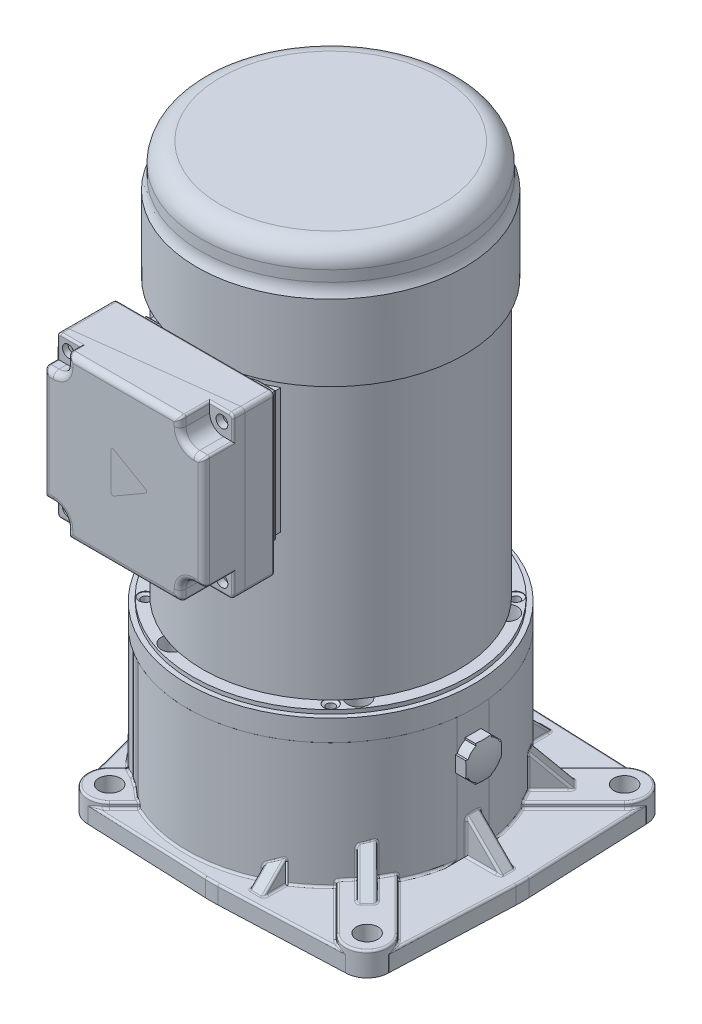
SolidWorks part; units mm, degrees
ref_plane "前视基准面" through (0, 0, 0) normal (0, 0, 1) x (1, 0, 0)
ref_plane "上视基准面" through (0, 0, 0) normal (0, 1, 0) x (1, 0, 0)
ref_plane "右视基准面" through (0, 0, 0) normal (1, 0, 0) x (0, 0, -1)
imported_body "接线盒座-1-surface1"
imported_body "接线盒座-1-surface2"
imported_body "接线盒座-1-surface3"
imported_body "接线盒座-1-surface4"
imported_body "接线盒座-1-surface5"
imported_body "接线盒盖-1-surface1"
imported_body "接线盒盖-1-surface2"
imported_body "接线盒盖-1-surface3"
imported_body "立式箱体装配.SLDPRT-1/15.11.08 22箱盖B-1-surface1"
imported_body "立式箱体装配.SLDPRT-1/15.05.20 22立式B-1-surface1"
imported_body "立式箱体装配.SLDPRT-1/3轴22-1-surface1"
imported_body "立式箱体装配.SLDPRT-1/3轴22-1-surface2"
imported_body "立式箱体装配.SLDPRT-1/GB／T13871．1-2007唇形密封圈B型B1525X40X7-1-surface1"
imported_body "立式箱体装配.SLDPRT-1/透气塞-1-surface1"
imported_body "立式箱体装配.SLDPRT-1/7X32-1-surface1"
sketch "草图1" plane through (0, -156.6427, 0) normal (0, 1, 0) x (1, 0, 0)
  circle A0 centre (438.6108, 106.9711) radius 65
extrude "凸台-拉伸1" add sketch "草图1" along normal blind 140
sketch "草图2" plane through (0, -16.6427, 0) normal (0, 1, 0) x (1, 0, 0)
  circle A0 centre (438.6108, 106.9711) radius 68
extrude "凸台-拉伸2" add sketch "草图2" along normal blind 38.5
sketch "草图3" plane through (0, 21.8573, 0) normal (0, 1, 0) x (1, 0, 0)
  circle A0 centre (438.6108, 106.9711) radius 66
extrude "凸台-拉伸3" add sketch "草图3" along normal blind 21.5
fillet "圆角1" radius 10 2 edges at (438.6108, 43.3573, -40.9711) (438.6108, 21.8573, -40.9711)
